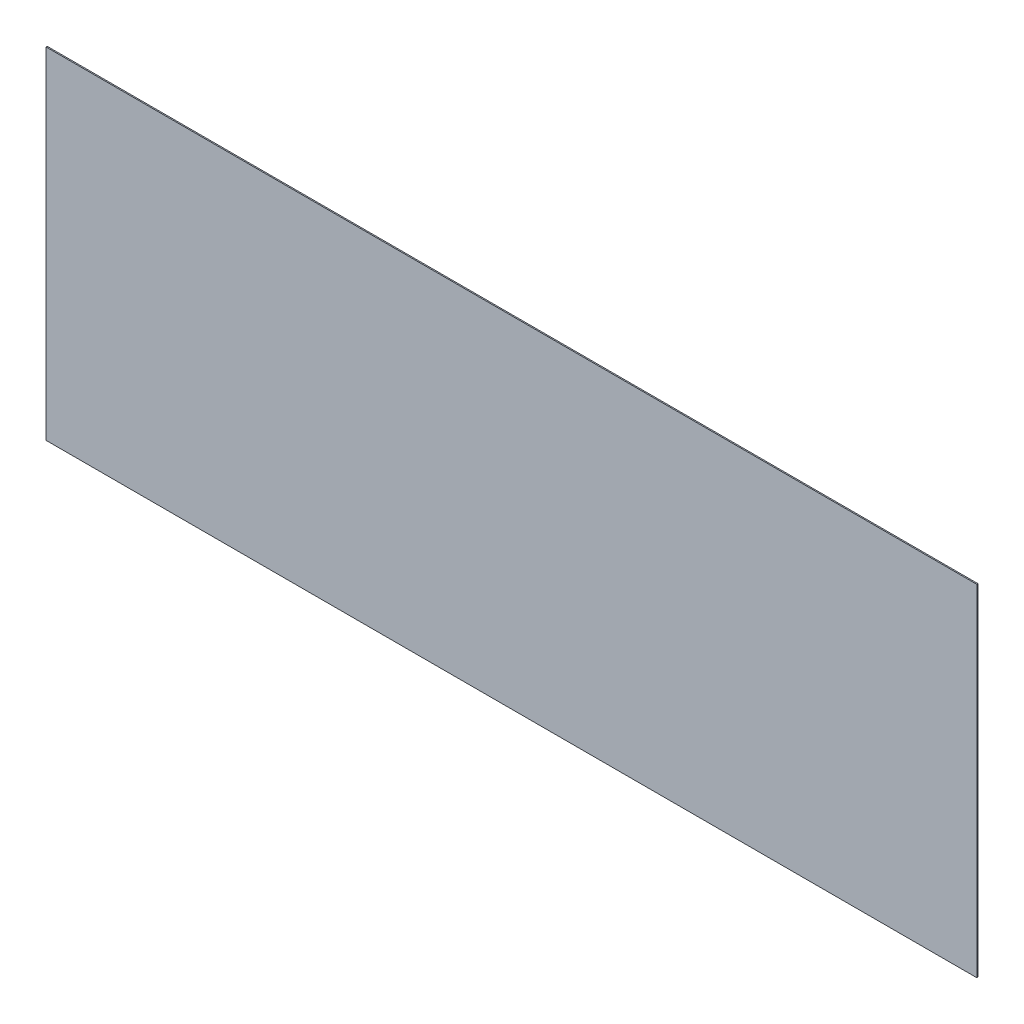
SolidWorks part; units mm, degrees
ref_plane "Plan de face" through (0, 0, 0) normal (0, 0, 1) x (1, 0, 0)
ref_plane "Plan de dessus" through (0, 0, 0) normal (0, 1, 0) x (1, 0, 0)
ref_plane "Plan de droite" through (0, 0, 0) normal (1, 0, 0) x (0, 0, -1)
sketch "Esquisse1" plane through (0, 0, 0) normal (0, 0, 1) x (1, 0, 0)
  line L1 (1325, -485) -> (-1325, -485)
  line L2 (1325, -485) -> (1325, 485)
  line L3 (1325, 485) -> (-1325, 485)
  line L4 (-1325, -485) -> (-1325, 485)
  line L5 (1325, -485) -> (-1325, 485) construction
  line L6 (1325, 485) -> (-1325, -485) construction
  point P0 (0, 0)
  dimension "D1" = 970
  dimension "D2" = 2650
extrude "Boss.-Extru.1" add sketch "Esquisse1" along normal blind 3.3074
sketch "Esquisse2" plane through (0, 0, 0) normal (1, 0, 0) x (0, 0, -1)
  line L0 (1852.6182, 0) -> (63.1264, 479.4929) construction
  line L1 (63.1264, 479.4929) -> (-3.3074, 0) construction
  line L2 (-3.3074, -485) -> (-3.3074, 485) construction
  line L3 (-3.3074, 0) -> (1852.6182, 0) construction
  line L4 (1852.6182, 0) -> (63.1264, -479.4929) construction
  line L5 (63.1264, -479.4929) -> (-187.928, 457.4552)
  line L6 (-187.928, 457.4552) -> (63.1264, 479.4929)
  circle A0 centre (1852.6182, 0) radius 1852.6182
  dimension "D1" = 3705.2364
  dimension "D2" = 30
  dimension "D3" = 970
  dimension "D4" = 252.0199
